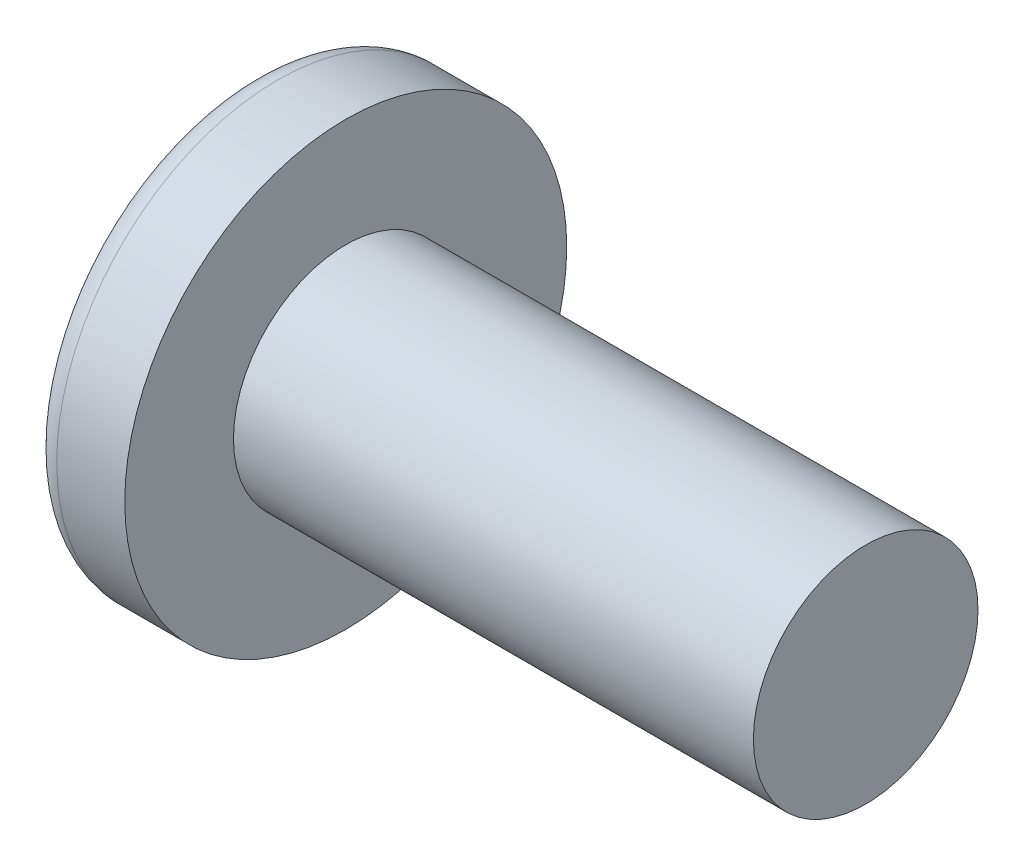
SolidWorks part; units mm, degrees
ref_plane "Plane1" through (0, 0, 0) normal (0, 0, 1) x (1, 0, 0)
ref_plane "Plane2" through (0, 0, 0) normal (0, 1, 0) x (1, 0, 0)
ref_plane "Plane3" through (0, 0, 0) normal (1, 0, 0) x (0, 0, -1)
sketch "BodySke" plane through (0, 0, 0) normal (0, 0, 1) x (1, 0, 0)
  line L0 (3.8354, 2.7432) -> (3.8354, 5.3975)
  line L1 (4.2888, 6.35) -> (4.2888, -3.175) construction
  line L2 (-25.4, 0) -> (127, 0) construction
  line L3 (16.5354, 0) -> (0, 0)
  line L4 (3.8354, 2.7432) -> (16.5354, 2.7432)
  line L5 (16.5354, 2.7432) -> (16.5354, 0)
  line L6 (2.1729, 5.3975) -> (3.8354, 5.3975)
  line L7 (3.8354, -2.7432) -> (16.5354, -2.7432) construction
  line L8 (3.8354, 6.35) -> (3.8354, -3.175) construction
  arc A0 (1.6578, 5.1339) -> (0, 0) centre (8.7782, 0) ccw
  arc A2 (1.6578, 5.1339) -> (2.1729, 5.3975) centre (2.1729, 4.7625) cw
revolve "Base-Revolve" add sketch "BodySke" angle 360 about L2
sketch "Sketch3" plane through (0, 0, 0) normal (1, 0, 0) x (0, 0, -1)
  line L0 (0.6477, -3.4544) -> (-0.6477, -3.4544)
  line L1 (0.6477, -3.4544) -> (0.6477, 3.4544)
  line L2 (-0.6477, 3.4544) -> (0.6477, 3.4544)
  line L3 (-0.6477, 3.4544) -> (-0.6477, -3.4544)
ref_plane "Plane4" through (4.0132, 0, 0) normal (1, 0, 0) x (0, 0, -1)
sketch "Sketch4" plane through (4.0132, 0, 0) normal (1, 0, 0) x (0, 0, -1)
  line L0 (0.3238, -0.3238) -> (-0.3238, -0.3239)
  line L1 (0.3238, -0.3238) -> (0.3238, 0.3238)
  line L2 (-0.3238, 0.3238) -> (0.3238, 0.3238)
  line L3 (-0.3238, 0.3238) -> (-0.3238, -0.3239)
loft "Cut-Loft1" cut profiles "Sketch3", "Sketch4"
pattern_circular "CirPattern1" count 2 every 90 about axis through (0, 0, 0) along (1, 0, 0) of "Cut-Loft1"
sketch "ThdSchSke" plane through (0, 0, 0) normal (0, 0, 1) x (1, 0, 0)
  line L0 (4.7422, -2.2022) -> (4.3634, -2.7432)
  line L1 (4.7422, -2.2022) -> (5.121, -2.7432)
  line L2 (5.121, -2.7432) -> (5.121, -3.429)
  line L3 (-3.175, 0) -> (5.1513, 0) construction
  line L5 (5.121, -3.429) -> (4.3634, -3.429)
  line L6 (4.3634, -3.429) -> (4.3634, -2.7432)
revolve "ThreadSchematic" [suppressed] cut sketch "ThdSchSke" angle 360 about L3
pattern_linear "ThdSchPat" [suppressed]
equation "\"D1@Sketch3\" = \"Cross_dia@Sketch3\" / 2"
equation "\"D2@Sketch3\" = \"Cross_width@Sketch3\" / 2"
equation "\"D1@Sketch4\" = \"Cross_width@Sketch3\" *.5"
equation "\"D2@Sketch4\" = \"D1@Sketch4\""
equation "\"D3@Sketch4\" = \"D1@Sketch4\" / 2"
equation "\"D4@Sketch4\" = \"D2@Sketch4\" / 2"
equation "\"Thread_length@ThreadCosmetic\" = ((sgn( (\"Length@BodySke\" - \"Advance@BodySke\" ) - \"Thread_nom@BodySke\" )-1)*( (\"Length@BodySke\" - \"Advance@BodySke\" ) - \"Thread_nom@BodySke\" ))/-2+ \"Thread_nom@BodySke\""
equation "\"Thread_minor@ThdSchSke\" = \"Thread_minor@ThreadCosmetic\""
equation "\"Diameter@ThdSchSke\" = \"Diameter@BodySke\""
equation "\"Overcut@ThdSchSke\" = \"Diameter@BodySke\" * 1.25"
equation "\"Start@ThdSchSke\" = \"Head_ht@BodySke\" + \"Length@BodySke\" - \"Thread_length@ThreadCosmetic\"  '---Non-countersunk---"
equation "\"Num_threads@ThdSchPat\" = int( \"Thread_length@ThreadCosmetic\" / \"Advance@BodySke\" + 0.999 )  + 1"
equation "\"Advance@ThdSchPat\" = \"Thread_length@ThreadCosmetic\" /  (\"Num_threads@ThdSchPat\" - 1) 'relax it"
